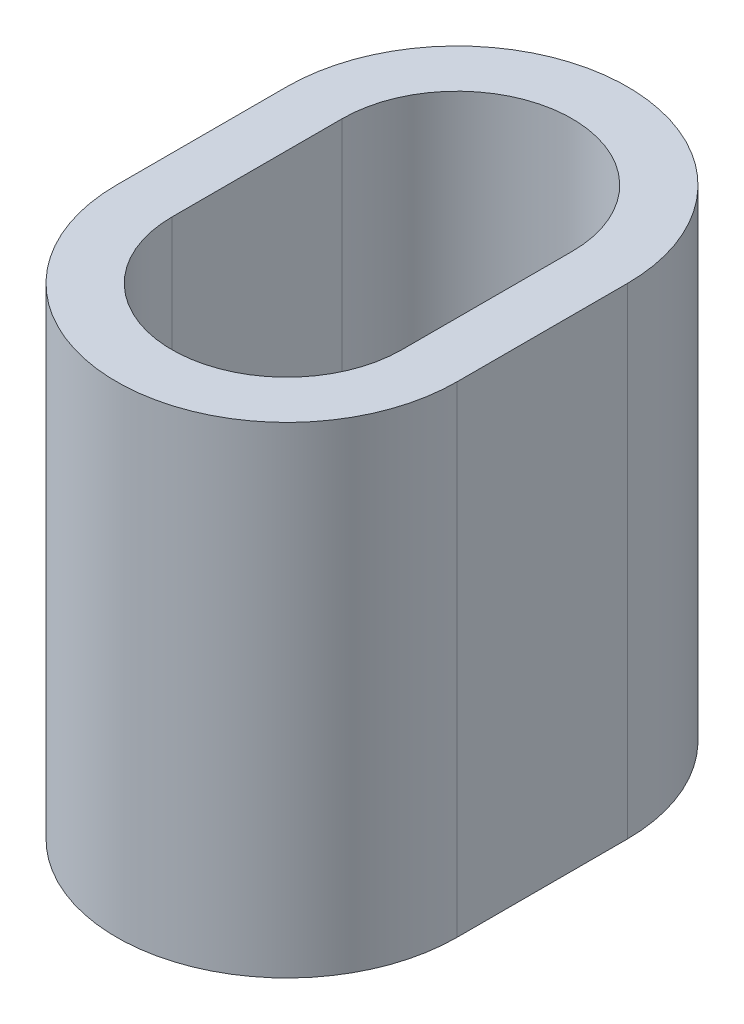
SolidWorks part; units mm, degrees
ref_plane "Plan de face" through (0, 0, 0) normal (0, 0, 1) x (1, 0, 0)
ref_plane "Plan de dessus" through (0, 0, 0) normal (0, 1, 0) x (1, 0, 0)
ref_plane "Plan de droite" through (0, 0, 0) normal (1, 0, 0) x (0, 0, -1)
ref_plane "Plan4" through (0, 0, 0) normal (0, -1, 0) x (1, 0, 0)
sketch "Esquisse1" plane through (0, 0, 0) normal (0, -1, 0) x (1, 0, 0)
  line L0 (-2.7, -2) -> (-2.7, 2)
  line L1 (2.7, 2) -> (2.7, -2)
  line L2 (4, -2) -> (4, 2)
  line L3 (-4, 2) -> (-4, -2)
  arc A0 (2.7, -2) -> (-2.7, -2) centre (0, -2) cw
  arc A1 (-2.7, 2) -> (2.7, 2) centre (0, 2) cw
  arc A2 (4, 2) -> (-4, 2) centre (0, 2) ccw
  arc A3 (-4, -2) -> (4, -2) centre (0, -2) ccw
  dimension "D1" = 2.7
  dimension "D2" = 2.7
  dimension "D3" = 4
  dimension "D4" = 2
  dimension "D5" = 1.3
extrude "Boss.-Extru.1" add sketch "Esquisse1" against normal blind 11.3
